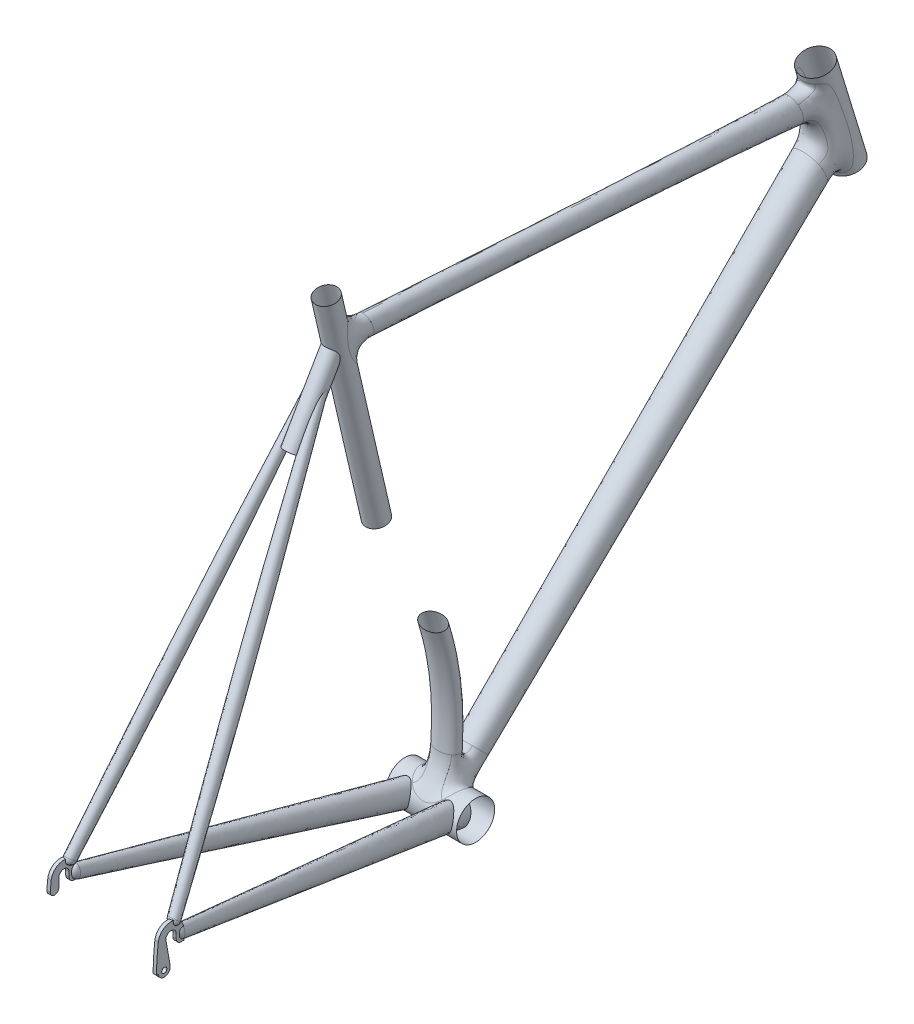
SolidWorks part; units mm, degrees
other "Top Tube"
other "Bottom Bracket"
other "Seat Tube, Lower "
other "Seat Tube, Upper "
other "Down Tube"
other "Head Tube"
other "Dropout, Left"
other "Dropout, Right"
other "Chain Stay, Right"
other "Chain Stay, Left"
other "Seat Stay, Right"
other "Seat Stay, Left"
ref_plane "Front Plane" through (0, 0, 0) normal (0, 0, 1) x (1, 0, 0)
ref_plane "Top Plane" through (0, 0, 0) normal (0, 1, 0) x (1, 0, 0)
ref_plane "Right Plane" through (0, 0, 0) normal (1, 0, 0) x (0, 0, -1)
sketch "Tube Centerlines" plane through (0, 0, 0) normal (1, 0, 0) x (0, 0, -1)
  line L0 (378.0551, 266.7) -> (837.7165, 719.7458)
  line L1 (378.0551, 266.7) -> (435.3368, 463.7667) construction
  line L2 (851.0837, 676.0236) -> (815.4378, 792.6162)
  line L3 (378.0551, 266.7) -> (0, 350)
  line L4 (0, 350) -> (256.6378, 792.6162)
  line L5 (256.6378, 792.6162) -> (826.5771, 756.181)
  line L6 (256.6378, 792.6162) -> (378.0551, 266.7) construction
  line L7 (0, 55) -> (0, -55) construction
  dimension "D1" = 45.72
  dimension "D2" = 38.1
  dimension "D3" = 38.1
  dimension "D4" = 72.32
  dimension "D5" = 116.448
  dimension "D6" = 122.989
  dimension "D7" = 539.75
  dimension "D8" = 17
imported_body "Tube Cap 1"
imported_body "Tube Cap 2"
imported_body "Tube Cap 3"
imported_body "Tube Cap 4"
imported_body "Chain Stay, Left"
imported_body "Seat Stay, Left"
imported_body "Chain Stay, Right"
imported_body "Seat Stay, Right"
imported_body "Seat Stay, Center"
imported_body "Top Tube"
imported_body "Bottom Bracket"
imported_body "Seat Tube, Lower"
imported_body "Seat Tube, Upper"
imported_body "Down Tube"
imported_body "Head Tube"
imported_body "Dropout, Right"
imported_body "Dropout, Left"
surface "Chain Stay, Right Knit"
surface "Chain Stay, Left Knit"
surface "Seat Stay, Right Knit"
surface "Seat Stay, Left Knit"
ref_plane "Plane1" through (0, 368.5924, -107.1393) normal (0, 0.9603, -0.2791) x (1, 0, 0)
sketch "Upper Seat Tube Blend" plane through (0, 0, 0) normal (1, 0, 0) x (0, 0, -1)
  line L0 (269.5687, 821.0693) -> (283.2907, 761.6327) construction
  line L1 (303.7763, 588.437) -> (245.2103, 842.1142) construction
  line L2 (285.8531, 812.7692) -> (294.2886, 776.2314)
  line L4 (256.6378, 792.6162) -> (826.5771, 756.181) construction
  line L5 (256.6378, 792.6162) -> (378.0551, 266.7) construction
  line L6 (259.1346, 787.3581) -> (293.7247, 795.3439) construction
  ellipse E0 centre (276.4297, 791.351) end of major axis (269.5687, 821.0693) minor radius 17.75 (285.8531, 812.7692) -> (294.2886, 776.2314) ccw
  dimension "D1" = 61
  dimension "D2" = 35.5
  dimension "D3" = 19
  dimension "D4" = 33
sketch "Head Tube Blend" plane through (0, 0, 0) normal (1, 0, 0) x (0, 0, -1)
  arc A0 (782.7914, 778.2013) -> (785.9539, 768.5651) centre (627.0633, 721.7563) cw
  arc A1 (796.4719, 717.05) -> (803.6708, 702.9583) centre (634.0743, 625.2026) cw
  arc A2 (785.9539, 768.5651) -> (790.675, 747.6116) centre (627.0633, 721.7563) cw
  arc A3 (790.675, 747.6116) -> (792.0611, 736.3508) centre (627.0633, 721.7563) cw
  arc A4 (803.6708, 702.9583) -> (813.5251, 676.2549) centre (634.0743, 625.2026) cw
  arc A5 (813.5251, 676.2549) -> (816.3144, 665.1709) centre (634.0743, 625.2026) cw
  spline S0 degree 3 poles (791.0459, 779.6038) (795.7312, 780.3476) (800.4165, 781.0915) (804.099, 781.4265) knots 0 0 0 0 0.078134 0.078134 0.078134 0.078134
  spline S1 degree 3 poles (835.129, 674.9911) (832.3021, 673.2012) (824.3083, 669.186) (816.3144, 665.1709) knots 0.926015 0.926015 0.926015 0.926015 1 1 1 1
  spline S2 degree 3 poles (804.099, 781.4265) (810.9979, 782.0541) (819.3231, 775.748) (833.5498, 733.4658) (841.4995, 708.3482) (842.9574, 680.3232) (837.172, 676.2847) (835.129, 674.9911) knots 0.078134 0.078134 0.078134 0.078134 0.166979 0.457547 0.746011 0.872546 0.926015 0.926015 0.926015 0.926015
sketch "Lower Seat Tube Blend" plane through (0, 0, 0) normal (1, 0, 0) x (0, 0, -1)
  line L0 (399.2769, 319.0604) -> (406.245, 311.9906)
  line L1 (353.8646, 319.0555) -> (379.1969, 317.6256)
  line L3 (406.245, 311.9906) -> (422.9164, 295.0757)
  line L4 (422.9164, 295.0757) -> (430.2528, 287.6322)
  line L5 (393.6721, 316.8086) -> (398.9212, 316.5123)
  line L6 (379.1969, 317.6256) -> (393.6721, 316.8086)
  line L7 (378.0551, 266.7) -> (837.7165, 719.7458) construction
sketch "Bottom Bracket Blend" plane through (0, -383.8478, -2695.7663) normal (0, -0.9603, 0.2791) x (1, 0, 0)
  line L2 (0, 2438.9275) -> (0, 2375.4275) construction
  line L3 (0, 2365.4934) -> (0, 3026.0392) construction
  line L5 (-25, 2407.1775) -> (25, 2407.1775) construction
  ellipse E0 centre (0, 2407.1775) end of major axis (0, 2375.4275) minor radius 25 (-17.282, 2430.1197) -> (-17.282, 2384.2354) ccw
  ellipse E1 centre (0, 2407.1775) end of major axis (0, 2438.9275) minor radius 25 (17.282, 2430.1197) -> (-17.282, 2430.1197) ccw
  ellipse E2 centre (0, 2407.1775) end of major axis (0, 2438.9275) minor radius 25 (-17.282, 2384.2354) -> (17.282, 2384.2354) ccw
  ellipse E3 centre (0, 2407.1775) end of major axis (0, 2438.9275) minor radius 25 (17.282, 2384.2354) -> (17.282, 2430.1197) ccw
  dimension "D1" = 50
  dimension "D2" = 63.5
surface "Surface-Trim1"
surface "Surface-Loft1"
surface "Surface-Trim2"
other "Boundary-Surface1"
other "Boundary-Surface2"
other "Boundary-Surface3"
surface "Surface-Fill1"
mirror "Mirror1" about plane through (0, 0, 0) normal (1, 0, 0)
surface "Surface-Knit1"
surface "Surface-Trim3"
wrap "Wrap1" sketch "Bottom Bracket Blend" wrap type scribe source sketch "Bottom Bracket Blend"
other "DeleteFace1"
surface "Surface-Loft2"
surface "Surface-Loft3"
surface "Surface-Loft4"
surface "Surface-Fill2"
surface "Surface-Fill3"
